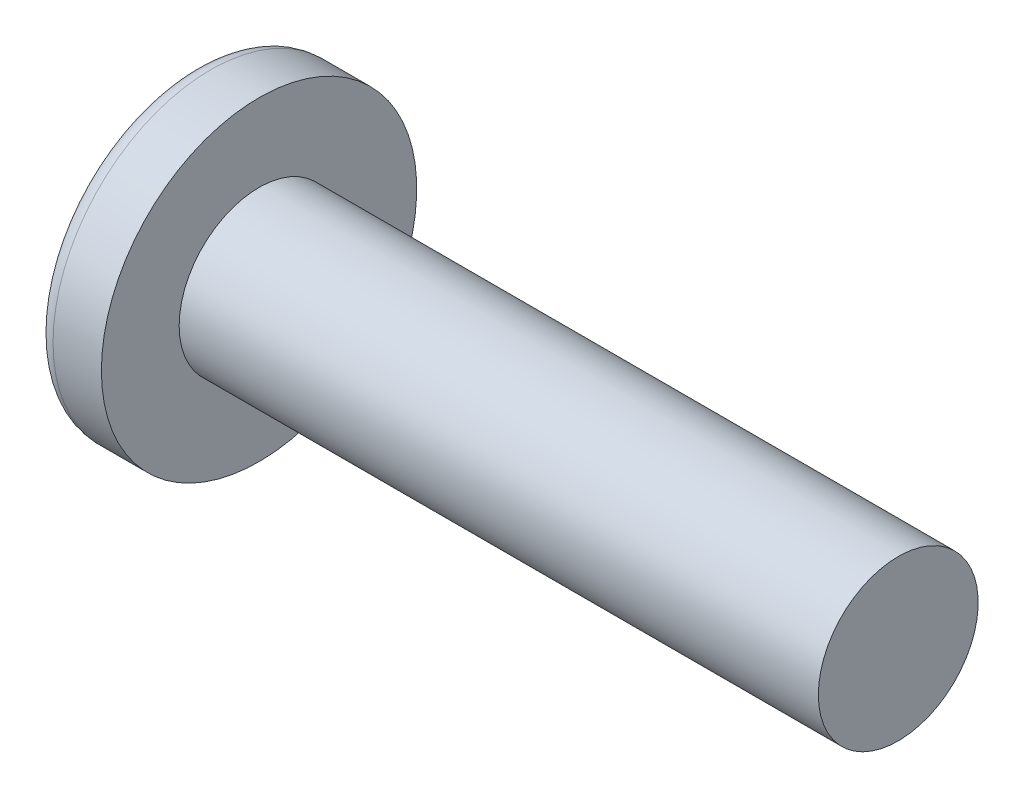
SolidWorks part; units mm, degrees
ref_plane "Plane1" through (0, 0, 0) normal (0, 0, 1) x (1, 0, 0)
ref_plane "Plane2" through (0, 0, 0) normal (0, 1, 0) x (1, 0, 0)
ref_plane "Plane3" through (0, 0, 0) normal (1, 0, 0) x (0, 0, -1)
sketch "BodySke" plane through (0, 0, 0) normal (0, 0, 1) x (1, 0, 0)
  line L0 (6.6294, 4.7625) -> (6.6294, 9.398)
  line L1 (7.4232, 6.35) -> (7.4232, -3.175) construction
  line L2 (-25.4, 0) -> (127, 0) construction
  line L3 (44.7294, 0) -> (0, 0)
  line L4 (6.6294, 4.7625) -> (44.7294, 4.7625)
  line L5 (44.7294, 4.7625) -> (44.7294, 0)
  line L6 (3.7481, 9.398) -> (6.6294, 9.398)
  line L7 (6.6294, -4.7625) -> (44.7294, -4.7625) construction
  line L8 (12.9794, 6.35) -> (12.9794, -3.175) construction
  arc A0 (2.9272, 8.9807) -> (0, 0) centre (15.24, 0) ccw
  arc A2 (2.9272, 8.9807) -> (3.7481, 9.398) centre (3.7481, 8.382) cw
  dimension "Head_fillet_rad" = 1.016
  dimension "Head_crown_rad" = 15.24
  dimension "Head_ht" = 6.6294
  dimension "Diameter" = 9.525
  dimension "Length" = 38.1
  dimension "Head_dia" = 18.796
  dimension "Advance" = 1.5875
  dimension "Thread_nom" = 31.75
revolve "Base-Revolve" add sketch "BodySke" angle 360 about L2
sketch "Sketch3" plane through (0, 0, 0) normal (1, 0, 0) x (0, 0, -1)
  line L0 (1.0287, -6.096) -> (-1.0287, -6.096)
  line L1 (1.0287, -6.096) -> (1.0287, 6.096)
  line L2 (-1.0287, 6.096) -> (1.0287, 6.096)
  line L3 (-1.0287, 6.096) -> (-1.0287, -6.096)
  dimension "D1" = 6.096
  dimension "Cross_dia" = 12.192
  dimension "D2" = 1.0287
  dimension "Cross_width" = 2.0574
ref_plane "Plane4" through (7.2644, 0, 0) normal (1, 0, 0) x (0, 0, -1)
sketch "Sketch4" plane through (7.2644, 0, 0) normal (1, 0, 0) x (0, 0, -1)
  line L0 (0.5143, -0.5143) -> (-0.5143, -0.5144)
  line L1 (0.5143, -0.5143) -> (0.5143, 0.5143)
  line L2 (-0.5143, 0.5143) -> (0.5143, 0.5143)
  line L3 (-0.5143, 0.5143) -> (-0.5143, -0.5144)
  dimension "D1" = 1.0287
  dimension "D2" = 1.0287
  dimension "D3" = 0.5143
  dimension "D4" = 0.5143
loft "Cut-Loft1" cut profiles "Sketch3", "Sketch4"
pattern_circular "CirPattern1" count 2 every 90 about axis through (0, 0, 0) along (1, 0, 0) of "Cut-Loft1"
sketch "ThdSchSke" plane through (0, 0, 0) normal (0, 0, 1) x (1, 0, 0)
  line L0 (12.9794, -3.9688) -> (12.4236, -4.7625)
  line L1 (12.9794, -3.9688) -> (13.5352, -4.7625)
  line L2 (13.5352, -4.7625) -> (13.5352, -5.9531)
  line L3 (-3.175, 0) -> (5.1513, 0) construction
  line L5 (13.5352, -5.9531) -> (12.4236, -5.9531)
  line L6 (12.4236, -5.9531) -> (12.4236, -4.7625)
  dimension "Thread_minor" = 7.9375
  dimension "Diameter" = 9.525
  dimension "Start" = 12.9794
  dimension "SideAngle" = 55
  dimension "VeeAngle" = 70
  dimension "Overcut" = 11.9063
revolve "ThreadSchematic" [suppressed] cut sketch "ThdSchSke" angle 360 about L3
pattern_linear "ThdSchPat" [suppressed]
equation "\"D1@Sketch3\" = \"Cross_dia@Sketch3\" / 2"
equation "\"D2@Sketch3\" = \"Cross_width@Sketch3\" / 2"
equation "\"D1@Sketch4\" = \"Cross_width@Sketch3\" *.5"
equation "\"D2@Sketch4\" = \"D1@Sketch4\""
equation "\"D3@Sketch4\" = \"D1@Sketch4\" / 2"
equation "\"D4@Sketch4\" = \"D2@Sketch4\" / 2"
equation "\"Thread_length@ThreadCosmetic\" = ((sgn( (\"Length@BodySke\" - \"Advance@BodySke\" ) - \"Thread_nom@BodySke\" )-1)*( (\"Length@BodySke\" - \"Advance@BodySke\" ) - \"Thread_nom@BodySke\" ))/-2+ \"Thread_nom@BodySke\""
equation "\"Thread_minor@ThdSchSke\" = \"Thread_minor@ThreadCosmetic\""
equation "\"Diameter@ThdSchSke\" = \"Diameter@BodySke\""
equation "\"Overcut@ThdSchSke\" = \"Diameter@BodySke\" * 1.25"
equation "\"Start@ThdSchSke\" = \"Head_ht@BodySke\" + \"Length@BodySke\" - \"Thread_length@ThreadCosmetic\"  '---Non-countersunk---"
equation "\"Num_threads@ThdSchPat\" = int( \"Thread_length@ThreadCosmetic\" / \"Advance@BodySke\" + 0.999 )  + 1"
equation "\"Advance@ThdSchPat\" = \"Thread_length@ThreadCosmetic\" /  (\"Num_threads@ThdSchPat\" - 1) 'relax it"
